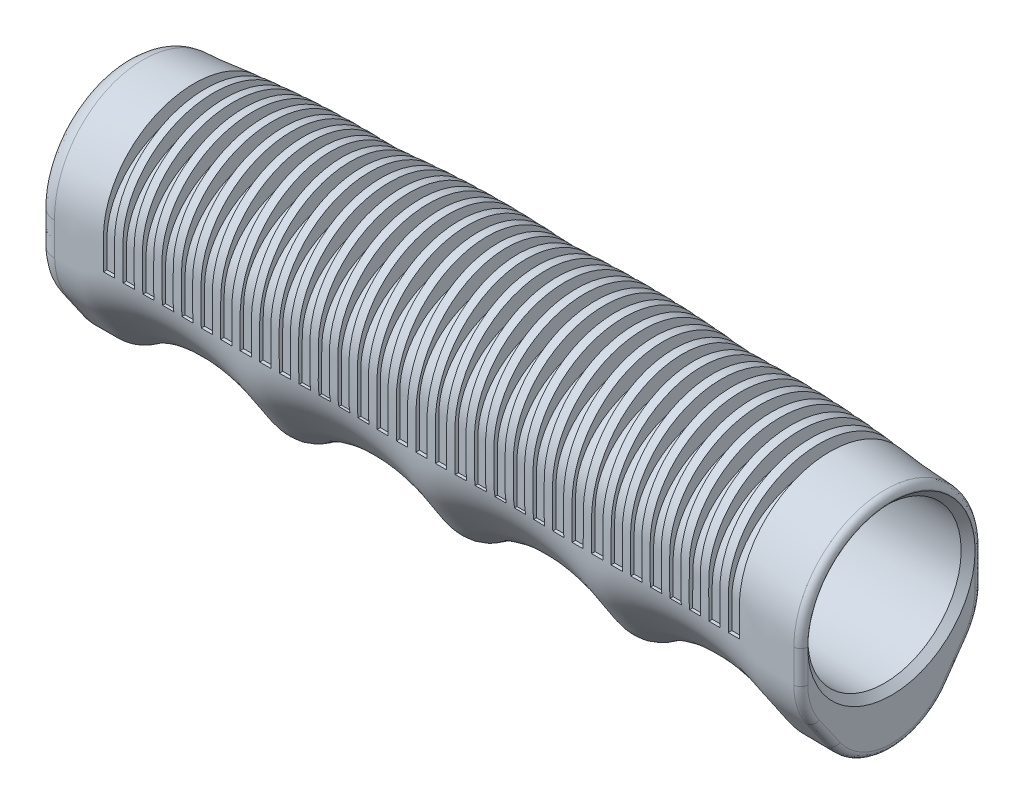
SolidWorks part; units mm, degrees
ref_plane "Plan de face" through (0, 0, 0) normal (0, 0, 1) x (1, 0, 0)
ref_plane "Plan de dessus" through (0, 0, 0) normal (0, 1, 0) x (1, 0, 0)
ref_plane "Plan de droite" through (0, 0, 0) normal (1, 0, 0) x (0, 0, -1)
sketch "Esquisse1" plane through (0, 0, 0) normal (1, 0, 0) x (0, 0, -1)
  line L0 (13, 0) -> (13, -4.7156)
  line L1 (-13, -4.7156) -> (-13, 0)
  line L2 (0, 16.5885) -> (0, -26.6587) construction
  line L3 (-8.1915, -14.7358) -> (-11.1915, -10.4513)
  line L4 (8.1915, -14.7358) -> (11.1915, -10.4513)
  arc A0 (-13, 0) -> (13, 0) centre (0, 0) cw
  arc A2 (-8.1915, -14.7358) -> (8.1915, -14.7358) centre (0, -9) ccw
  arc A3 (-11.1915, -10.4513) -> (-13, -4.7156) centre (-3, -4.7156) cw
  arc A4 (11.1915, -10.4513) -> (13, -4.7156) centre (3, -4.7156) ccw
  dimension "D1" = 13
  dimension "D2" = 35
  dimension "D4" = 10
  dimension "D5" = 10
  dimension "D7" = 32
ref_plane "Plan2" through (110, 0, 0) normal (1, 0, 0) x (0, 0, -1)
sketch "Esquisse5" plane through (110, 0, 0) normal (1, 0, 0) x (0, 0, -1)
  line L2 (13, -4.7156) -> (13, 0)
  line L3 (-13, 0) -> (-13, -4.7156)
  line L4 (13, -4.7156) -> (13, 0)
  line L5 (-13, 0) -> (-13, -4.7156)
  line L8 (8.1915, -14.7358) -> (11.1915, -10.4513)
  line L9 (8.1915, -14.7358) -> (11.1915, -10.4513)
  line L10 (-11.1915, -10.4513) -> (-8.1915, -14.7358)
  line L11 (-11.1915, -10.4513) -> (-8.1915, -14.7358)
  arc A2 (11.1915, -10.4513) -> (13, -4.7156) centre (3, -4.7156) ccw
  arc A3 (13, 0) -> (-13, 0) centre (0, 0) ccw
  arc A5 (13, 0) -> (-13, 0) centre (0, 0) ccw
  arc A8 (11.1915, -10.4513) -> (13, -4.7156) centre (3, -4.7156) ccw
  arc A9 (-8.1915, -14.7358) -> (8.1915, -14.7358) centre (0, -9) ccw
  arc A10 (-8.1915, -14.7358) -> (8.1915, -14.7358) centre (0, -9) ccw
  arc A11 (-13, -4.7156) -> (-11.1915, -10.4513) centre (-3, -4.7156) ccw
  arc A12 (-13, -4.7156) -> (-11.1915, -10.4513) centre (-3, -4.7156) ccw
  dimension "D1" = 0
sketch "Esquisse6" plane through (0, 0, 0) normal (0, 0, 1) x (1, 0, 0)
  line L0 (0, 16.5885) -> (0, -26.6587) construction
  line L1 (0, 0) -> (0, 13) construction
  line L2 (110, 0) -> (110, 13) construction
  arc A0 (0, 13) -> (110, 13) centre (55, -489.6667) cw
  dimension "D1" = 3
sketch "Esquisse7" plane through (0, 0, 0) normal (0, 0, 1) x (1, 0, 0)
  line L0 (0, -19) -> (6, -19)
  line L1 (0, 16.5885) -> (0, -26.6587) construction
  line L3 (104.6306, -19) -> (110, -19)
  line L5 (0, -19) -> (110, -19) construction
  line L6 (-6.9351, -15) -> (118.8664, -15) construction
  arc A0 (7.7613, -18.4286) -> (28.8964, -18.4286) centre (18.3288, -33) cw
  arc A1 (28.8964, -18.4286) -> (32.4189, -18.4286) centre (30.6577, -16) ccw
  arc A2 (32.4189, -18.4286) -> (53.5541, -18.4286) centre (42.9865, -33) cw
  arc A3 (53.5541, -18.4286) -> (57.0766, -18.4286) centre (55.3153, -16) ccw
  arc A4 (57.0766, -18.4286) -> (78.2117, -18.4286) centre (67.6441, -33) cw
  arc A5 (78.2117, -18.4286) -> (81.7342, -18.4286) centre (79.973, -16) ccw
  arc A6 (81.7342, -18.4286) -> (102.8694, -18.4286) centre (92.3018, -33) cw
  arc A7 (102.8694, -18.4286) -> (104.6306, -19) centre (104.6306, -16) ccw
  arc A8 (6, -19) -> (7.7613, -18.4286) centre (6, -16) ccw
  dimension "D1" = 3
  dimension "D2" = 18
  dimension "D3" = 3
  dimension "D4" = 18
  dimension "D5" = 3
  dimension "D7" = 3
  dimension "D8" = 18
  dimension "D9" = 3
  dimension "D10" = 18
  dimension "D11" = 6
  dimension "D6" = 4
loft "Lissage2" add profiles "Esquisse1", "Esquisse5"
sketch "Esquisse9" plane through (0, 0, 0) normal (-1, 0, 0) x (0, 0, 1)
  line L0 (0, 16.5885) -> (0, -26.6587) construction
  circle A0 centre (0, 0) radius 1.5
  dimension "D1" = 3
extrude "Enlèv. mat.-Extru.2" cut sketch "Esquisse9" against normal through all
sketch "Esquisse13" plane through (0, 0, 0) normal (0, 0, 1) x (1, 0, 0)
  line L1 (10, -2.9) -> (11.6, -2.9)
  line L2 (10, -2.9) -> (10, 22.1)
  line L3 (10, 22.1) -> (11.6, 22.1)
  line L4 (11.6, -2.9) -> (11.6, 22.1)
  line L5 (0, 13) -> (0, 0) construction
  dimension "D1" = 10
  dimension "D2" = 1.6
  dimension "D3" = 25
  dimension "D4" = 2.9
extrude "Enlèv. mat.-Extru.3" cut sketch "Esquisse13" against normal through all both and the other way through all
pattern_linear "Répétition linéaire1" count 33 spacing 2.8 along (1, 0, 0) of "Enlèv. mat.-Extru.3"
sketch "Esquisse10" plane through (0, 0, 0) normal (0, 0, 1) x (1, 0, 0)
  arc A0 (110, 13) -> (0, 13) centre (55, -489.6667) ccw construction
  arc A1 (110, 13) -> (0, 13) centre (55, -489.6667) ccw construction
  arc A2 (109.7825, 11.0119) -> (0.2175, 11.0119) centre (55, -489.6667) ccw
  dimension "D1" = 2
sketch "Esquisse14" plane through (0, 0, 0) normal (1, 0, 0) x (0, 0, -1)
  line L3 (13, 0) -> (13, -4.7156) construction
  line L6 (0, 16.5885) -> (0, -26.6587) construction
  line L7 (-12.5, 0) -> (-12.5, -3)
  line L9 (-12.5, -3) -> (12.5, -3)
  line L11 (12.5, -3) -> (12.5, 0)
  ellipse E0 centre (0, 0) end of major axis (-12.5, 0) minor radius 11.0119 (-12.5, 0) -> (12.5, 0) cw
  dimension "D1" = 0.5
  dimension "D3" = 3
sketch "Esquisse16" plane through (110, 0, 0) normal (1, 0, 0) x (0, 0, -1)
  line L3 (-12.5, -3) -> (12.5, -3)
  line L4 (-12.5, 0) -> (-12.5, -3)
  line L5 (12.5, -3) -> (12.5, 0)
  line L6 (-12.5, -3) -> (12.5, -3)
  line L7 (-12.5, 0) -> (-12.5, -3)
  line L8 (12.5, -3) -> (12.5, 0)
  ellipse E1 centre (0, 0) end of major axis (-12.5, 0) minor radius 11.0119 (12.5, 0) -> (-12.5, 0) ccw
  ellipse E2 centre (0, 0) end of major axis (-12.5, 0) minor radius 11.0119 (12.5, 0) -> (-12.5, 0) ccw
  dimension "D1" = 0
ref_plane "Plan5" through (0, -3, 0) normal (0, 1, 0) x (1, 0, 0)
sketch "Esquisse17" plane through (0, -3, 0) normal (0, 1, 0) x (1, 0, 0)
  line L0 (0, -12.5) -> (110, -12.5)
  line L1 (0, -12.5) -> (0, 12.5) construction
  line L2 (110, -12.5) -> (110, 12.5) construction
  line L3 (110, -12.5) -> (110, 12.5) construction
  line L4 (0, 12.5) -> (110, 12.5)
loft "Lissage5" add profiles "Esquisse14", "Esquisse16"
fillet "Congé3" radius 3 8 edges
fillet "Congé4" radius 1 8 edges
sketch "Esquisse18" plane through (110, 0, 0) normal (1, 0, 0) x (0, 0, -1)
  circle A0 centre (0, 0) radius 11
  dimension "D1" = 22
extrude "Enlèv. mat.-Extru.4" cut sketch "Esquisse18" against normal blind 105
chamfer "Chanfrein1" distance 1 angle 45 1 edges at (110, 0, -11)
sketch "Esquisse19" plane through (5, 0, 0) normal (1, 0, 0) x (0, 0, -1)
  circle A0 centre (0, 0) radius 1
  dimension "D1" = 2
extrude "Enlèv. mat.-Extru.5" cut sketch "Esquisse19" against normal through all
